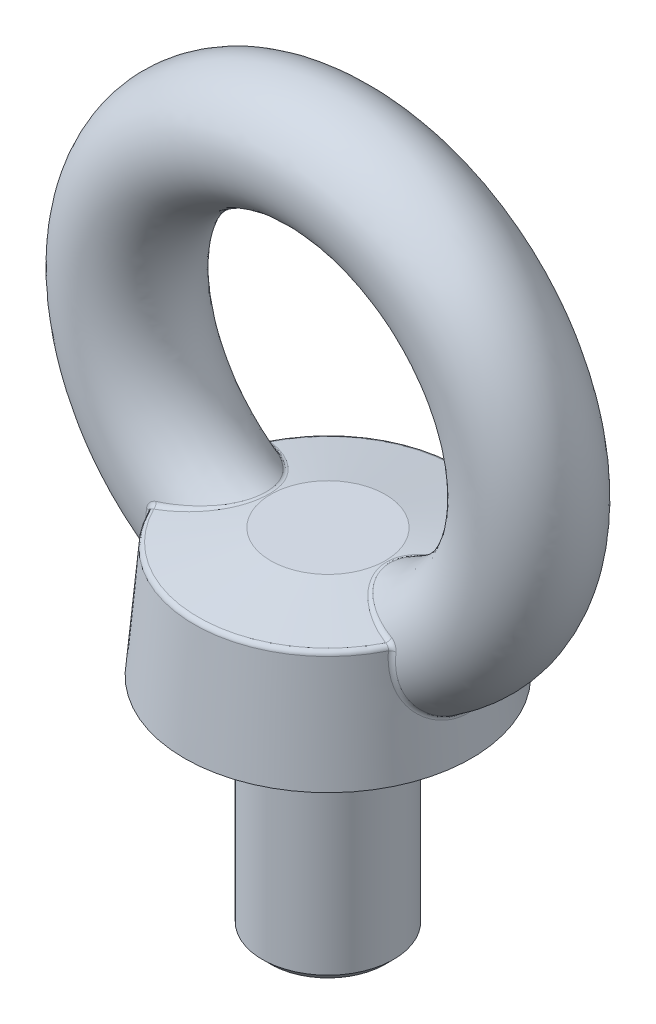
SolidWorks part; units mm, degrees
ref_plane "Front Plane" through (0, 0, 0) normal (0, 0, 1) x (1, 0, 0)
ref_plane "Top Plane" through (0, 0, 0) normal (0, 1, 0) x (1, 0, 0)
ref_plane "Right Plane" through (0, 0, 0) normal (1, 0, 0) x (0, 0, -1)
sketch "Sketch1" plane through (0, 0, 0) normal (0, 0, 1) x (1, 0, 0)
  ellipse E0 centre (0, 31) end of major axis (31.5, 31) minor radius 31
  dimension "D1" = 63
  dimension "D2" = 62
sketch "Sketch2" plane through (0, 0, 0) normal (1, 0, 0) x (0, 0, -1)
  line L3 (0, 62) -> (0, 0) construction
  circle A0 centre (0, 7) radius 7
  point P5 (0, 0)
sweep "Sweep1" add profiles "Sketch2" path "Sketch1"
sketch "Sketch3" plane through (0, 0, 0) normal (1, 0, 0) x (0, 0, -1)
  line L0 (0, 0) -> (-17.5, 0)
  line L1 (-17.5, 0) -> (-16.2752, 14)
  line L2 (-16.2752, 14) -> (-7, 15.6355)
  line L3 (-7, 15.6355) -> (0, 15.6355)
  line L4 (0, 15.6355) -> (0, 0)
revolve "Revolve1" add sketch "Sketch3" angle 360 about L4
fillet "Fillet1" radius 0.6 6 edges at (7.4007, 15.5595, 0.6682) (17.0542, 4.9681, 0.616) (-7.4007, 15.5595, -0.6682) (-17.0542, 4.9681, -0.616) (0, 14, -16.2752) (0, 14, 16.2752)
sketch "Sketch4" plane through (0, 0, 0) normal (0, -1, 0) x (1, 0, 0)
  circle A0 centre (0, 0) radius 8
  dimension "D1" = 16
extrude "Extrude1" add sketch "Sketch4" along normal blind 27
chamfer "Chamfer1" distance 1 angle 45 1 edges at (0, -27, -8)
sketch "Sketch5" plane through (0, 0, 0) normal (1, 0, 0) x (0, 0, -1)
  line L0 (-8, 0) -> (-8, -2.7321)
  line L1 (-8, 0) -> (-8, -26) construction
  line L2 (-7, -1) -> (-8, -2.7321)
  line L3 (-7, -1) -> (-7, -0.5)
  line L4 (-7.5, 0) -> (-8, 0)
  line L5 (-7.5, -0.5) -> (-7, -0.5) construction
  arc A1 (-7, -0.5) -> (-7.5, 0) centre (-7.5, -0.5) ccw
  point P0 (-7, -27)
  dimension "D1" = 30
revolve "Cut-Revolve1" cut sketch "Sketch5" angle 360 about axis through (0, -27, 0) along (0, 1, 0)
equation "\"D4@Sketch3\" = \"D1@Sketch2\""
equation "\"D5@Sketch3\" = \"D1@Sketch2\"/2"
